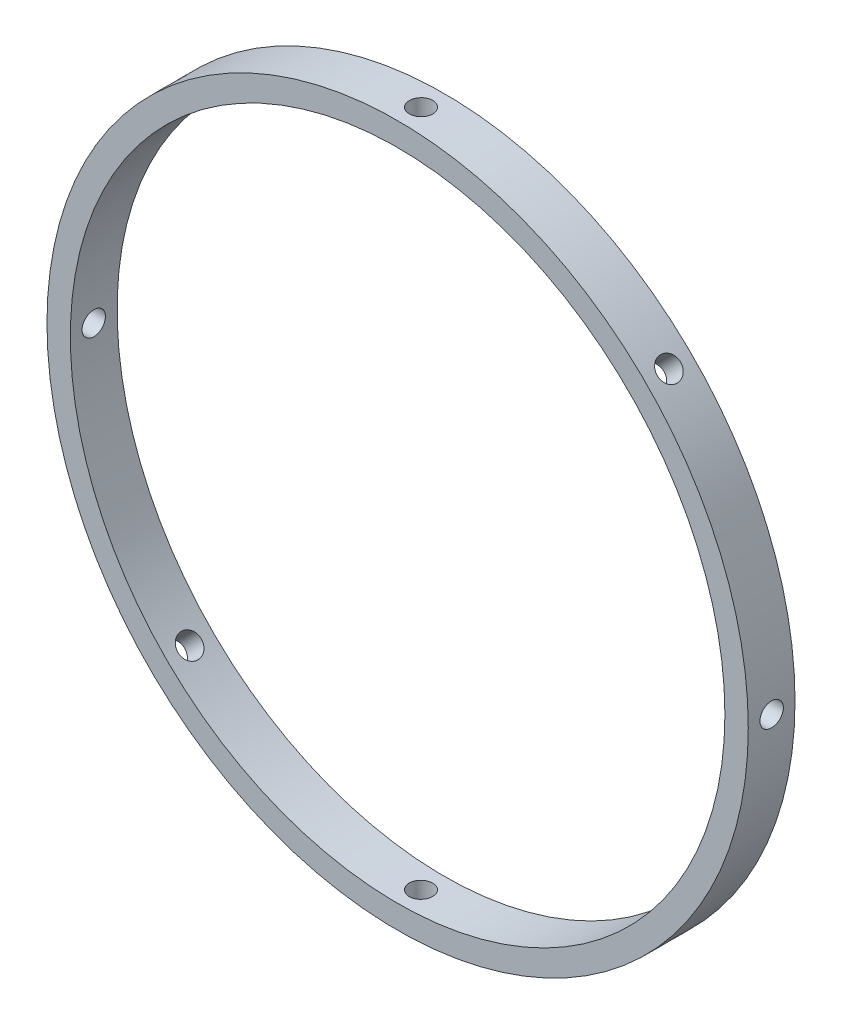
SolidWorks part; units mm, degrees
ref_plane "Alzado" through (0, 0, 0) normal (0, 0, 1) x (1, 0, 0)
ref_plane "Planta" through (0, 0, 0) normal (0, 1, 0) x (1, 0, 0)
ref_plane "Vista lateral" through (0, 0, 0) normal (1, 0, 0) x (0, 0, -1)
sketch "Croquis2" plane through (0, 0, 0) normal (0, 0, 1) x (1, 0, 0)
  circle A0 centre (0, 0) radius 300
  dimension "D1" = 600
extrude "Extruir-Lámina1" add sketch "Croquis2" along normal blind 40 thin
sketch "Croquis3" plane through (0, 0, 0) normal (1, 0, 0) x (0, 0, -1)
  line L0 (-20, 300) -> (-20, 0) construction
  line L1 (0, 300) -> (-40, 300) construction
  line L2 (-20, 0) -> (0, 0) construction
  circle A0 centre (-20, 0) radius 10
  point P6 (-20, 4.8188)
  dimension "D1" = 20
extrude "Cortar-Extruir1" cut sketch "Croquis3" against normal through all both and the other way through all
pattern_circular "MatrizC1" count 5 over 180 about axis through (0, 0, 40) along (0, 0, 1) of "Cortar-Extruir1"
